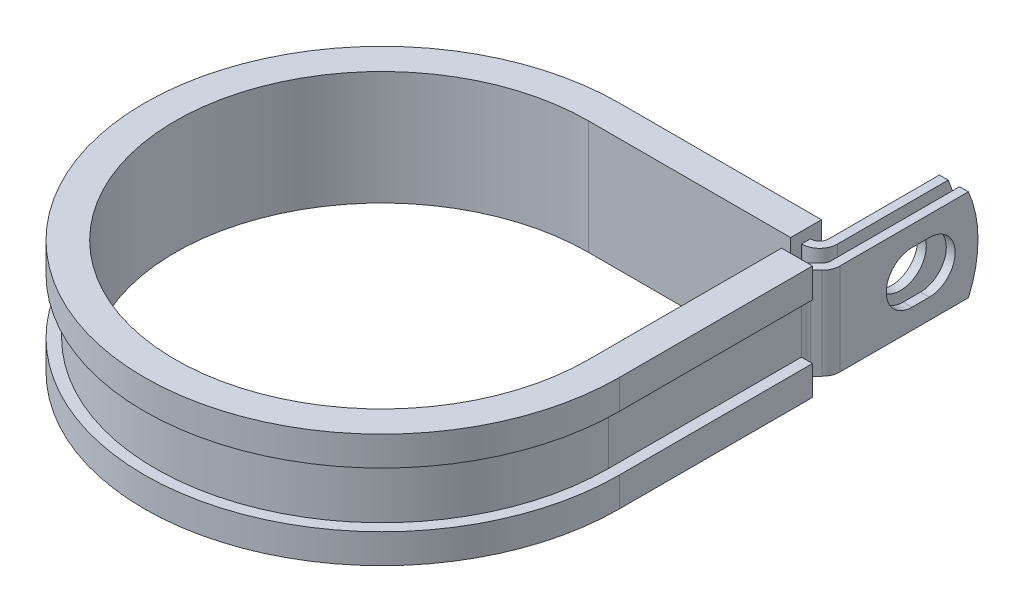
SolidWorks part; units mm, degrees
ref_plane "Front Plane" through (0, 0, 0) normal (0, 0, 1) x (1, 0, 0)
ref_plane "Top Plane" through (0, 0, 0) normal (0, 1, 0) x (1, 0, 0)
ref_plane "Right Plane" through (0, 0, 0) normal (1, 0, 0) x (0, 0, -1)
sketch "Sketch1" plane through (0, 0, 0) normal (0, 1, 0) x (1, 0, 0)
  line L0 (0, 30.099) -> (27.9833, 30.099)
  line L1 (30.099, 0) -> (30.099, 26.6865)
  line L2 (30.4217, 49.1998) -> (30.4217, 32.5374)
  line L3 (30.8132, 28.4107) -> (31.6394, 29.2369)
  line L5 (31.9965, 30.099) -> (31.9965, 49.1998)
  arc A0 (0, 30.099) -> (30.099, 0) centre (0, 0) ccw
  arc A1 (30.8132, 28.4107) -> (30.099, 26.6865) centre (32.5374, 26.6865) ccw
  arc A2 (31.6394, 29.2369) -> (31.9965, 30.099) centre (30.7773, 30.099) ccw
  arc A3 (27.9833, 30.099) -> (30.4217, 32.5374) centre (27.9833, 32.5374) ccw
extrude "Extrude-Thin1" add sketch "Sketch1" along normal mid plane 12.7 thin
sketch "Sketch2" plane through (29.2025, 0, 0) normal (-1, 0, 0) x (0, 0, 1)
  line L0 (-49.1998, 6.35) -> (-49.1998, -6.35) construction
  line L1 (0, 6.35) -> (0, -6.35) construction
  circle A0 centre (-41.275, 0) radius 3.5687
  point P2 (-49.1998, 0)
extrude "Cut-Extrude1" cut sketch "Sketch2" against normal up to surface (1.2192 mm away)
sketch "Sketch3" plane through (33.2157, 0, 0) normal (1, 0, 0) x (0, 0, -1)
  line L0 (40.0812, 0) -> (42.4688, 0) construction
  line L1 (40.0812, 3.5687) -> (42.4688, 3.5687)
  line L2 (40.0812, -3.5687) -> (42.4688, -3.5687)
  line L3 (49.1998, 6.35) -> (49.1998, -6.35) construction
  arc A0 (40.0812, 3.5687) -> (40.0812, -3.5687) centre (40.0812, 0) ccw
  arc A1 (42.4688, -3.5687) -> (42.4688, 3.5687) centre (42.4688, 0) ccw
  point P3 (41.275, 0)
  point P8 (49.1998, 0)
  point P11 (36.5125, 0)
  point P12 (46.0375, 0)
extrude "Cut-Extrude2" cut sketch "Sketch3" against normal up to surface (1.2192 mm away)
sketch "Sketch4" plane through (29.2025, 0, 0) normal (-1, 0, 0) x (0, 0, 1)
  line L0 (-49.1998, 6.35) -> (-49.1998, -6.35)
  line L1 (-49.1998, 6.35) -> (-47.8745, 6.35)
  line L2 (-49.1998, 6.35) -> (-32.5374, 6.35) construction
  line L3 (-49.1998, -6.35) -> (-47.8745, -6.35)
  line L4 (-49.1998, -6.35) -> (-32.5374, -6.35) construction
  arc A0 (-47.8745, 6.35) -> (-47.8745, -6.35) centre (-33.3248, 0) ccw
extrude "Cut-Extrude3" cut sketch "Sketch4" against normal through all contours A0 M4 M5 | A0 L0 M2
ref_plane "Plane1" through (0, 0, -26.6865) normal (0, 0, -1) x (-1, 0, 0)
ref_plane "Plane2" through (27.9325, 0, 0) normal (-1, 0, 0) x (0, 0, 1)
sketch "Sketch5" plane through (0, 0, -26.6865) normal (0, 0, -1) x (-1, 0, 0)
  line L0 (-31.3182, 6.35) -> (-30.099, 6.35)
  line L1 (-31.3182, 6.35) -> (-31.3182, -6.35) construction
  line L3 (-30.099, 6.35) -> (-30.099, -6.35)
  line L4 (-30.099, -6.35) -> (-31.3182, -6.35)
  line L5 (-31.3182, -6.35) -> (-31.3182, -3.81)
  line L6 (-31.3182, 6.35) -> (-31.3182, 3.81)
  line L7 (-32.8422, 7.874) -> (-32.8422, 3.81)
  line L8 (-32.8422, 7.874) -> (-28.575, 7.874)
  line L9 (-28.575, 7.874) -> (-28.575, -7.874)
  line L10 (-28.575, -7.874) -> (-32.8422, -7.874)
  line L11 (-32.8422, -7.874) -> (-32.8422, -3.81)
  line L12 (-32.8422, 3.81) -> (-31.3182, 3.81)
  line L13 (-31.3182, -3.81) -> (-32.8422, -3.81)
sketch "Sketch6" plane through (0, 6.35, 0) normal (0, 1, 0) x (1, 0, 0)
  line L0 (28.575, 0) -> (28.575, 26.6865)
  line L1 (28.575, 26.6865) -> (32.8422, 26.6865) construction
  line L2 (27.9325, 6.9878) -> (27.9325, -6.9878) construction
  line L5 (0, 28.575) -> (27.9325, 28.575)
  arc A0 (0, 28.575) -> (28.575, 0) centre (0, 0) ccw
sweep "Sweep1" add profiles "Sketch5" path "Sketch6"
equation "\"D4@Sketch5\" = \"D1@Extrude-Thin1\""
equation "\"D5@Sketch5\" = \"D5@Extrude-Thin1\""
equation "\"D1@Sketch3\" = \"D2@Sketch2\""
equation "\"D7@Sketch1\" = \"D3@Sketch2\" + \"D1@Sketch3\""
equation "\"D1@Sketch1\" = \"D1@Sketch6\" + 2 * \"D3@Sketch5\""
equation "\"D1@Sketch4\" = ( \"D1@Extrude-Thin1\" + .125 ) * 2"
equation "\"D9@Sketch1\"= \"D5@Extrude-Thin1\""
equation "\"D8@Sketch1\"= 2 * \"D5@Extrude-Thin1\""
equation "\"D2@Sketch1\" = 2 * \"D5@Extrude-Thin1\""
equation "\"D2@Sketch3\" = \"D1@Sketch2\""
